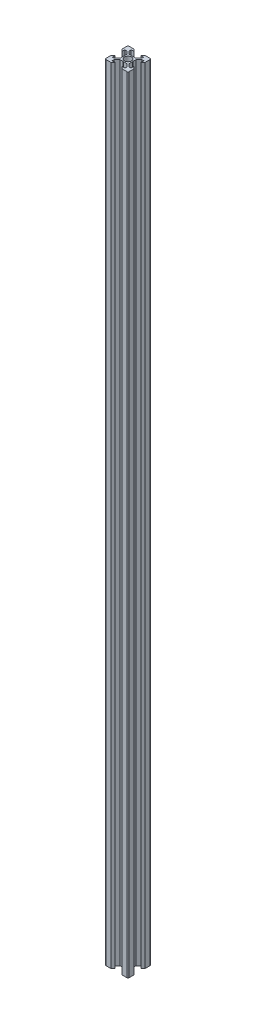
SolidWorks part; units mm, degrees
ref_plane "Front Plane" through (0, 0, 0) normal (0, 0, 1) x (1, 0, 0)
ref_plane "Top Plane" through (0, 0, 0) normal (0, 1, 0) x (1, 0, 0)
ref_plane "Right Plane" through (0, 0, 0) normal (1, 0, 0) x (0, 0, -1)
sketch "Sketch1" plane through (0, 0, 0) normal (0, 1, 0) x (1, 0, 0)
  line L0 (9.9996, -8.9996) -> (9.9996, -4.7998)
  line L1 (9.9996, -4.7998) -> (8.1997, -2.9999)
  line L2 (8.1997, -2.9999) -> (8.1997, -5.4998)
  line L3 (8.1997, -5.4998) -> (6.5604, -5.4998)
  line L4 (6.5604, -5.4998) -> (3.9998, -2.9392)
  line L5 (3.9998, -2.9392) -> (3.9998, -0.3)
  line L6 (3.9998, -0.3) -> (3.6999, 0)
  line L7 (3.6999, 0) -> (3.9998, 0.3)
  line L8 (3.9998, 0.3) -> (3.9998, 2.9392)
  line L9 (3.9998, 2.9392) -> (6.5604, 5.4998)
  line L10 (6.5604, 5.4998) -> (8.1997, 5.4998)
  line L11 (8.1997, 5.4998) -> (8.1997, 2.9999)
  line L12 (8.1997, 2.9999) -> (9.9996, 4.7998)
  line L13 (9.9996, 4.7998) -> (9.9996, 8.9996)
  line L14 (8.9996, 9.9996) -> (4.7998, 9.9996)
  line L15 (4.7998, 9.9996) -> (2.9999, 8.1997)
  line L16 (2.9999, 8.1997) -> (5.4998, 8.1997)
  line L17 (5.4998, 8.1997) -> (5.4998, 6.5604)
  line L18 (5.4998, 6.5604) -> (2.9392, 3.9998)
  line L19 (2.9392, 3.9998) -> (0.3, 3.9998)
  line L20 (0.3, 3.9998) -> (0, 3.6999)
  line L21 (0, 3.6999) -> (-0.3, 3.9998)
  line L22 (-0.3, 3.9998) -> (-2.9392, 3.9998)
  line L23 (-2.9392, 3.9998) -> (-5.4998, 6.5604)
  line L24 (-5.4998, 6.5604) -> (-5.4998, 8.1997)
  line L25 (-5.4998, 8.1997) -> (-2.9999, 8.1997)
  line L26 (-2.9999, 8.1997) -> (-4.7998, 9.9996)
  line L27 (-4.7998, 9.9996) -> (-8.9996, 9.9996)
  line L28 (-9.9996, 8.9996) -> (-9.9996, 4.7998)
  line L29 (-9.9996, 4.7998) -> (-8.1997, 2.9999)
  line L30 (-8.1997, 2.9999) -> (-8.1997, 5.4998)
  line L31 (-8.1997, 5.4998) -> (-6.5604, 5.4998)
  line L32 (-6.5604, 5.4998) -> (-3.9998, 2.9392)
  line L33 (-3.9998, 2.9392) -> (-3.9998, 0.3)
  line L34 (-3.9998, 0.3) -> (-3.6999, 0)
  line L35 (-3.6999, 0) -> (-3.9998, -0.3)
  line L36 (-3.9998, -0.3) -> (-3.9998, -2.9392)
  line L37 (-3.9998, -2.9392) -> (-6.5604, -5.4998)
  line L38 (-6.5604, -5.4998) -> (-8.1997, -5.4998)
  line L39 (-8.1997, -5.4998) -> (-8.1997, -2.9999)
  line L40 (-8.1997, -2.9999) -> (-9.9996, -4.7998)
  line L41 (-9.9996, -4.7998) -> (-9.9996, -8.9996)
  line L42 (-8.9996, -9.9996) -> (-4.7998, -9.9996)
  line L43 (-4.7998, -9.9996) -> (-2.9999, -8.1997)
  line L44 (-2.9999, -8.1997) -> (-5.4998, -8.1997)
  line L45 (-5.4998, -8.1997) -> (-5.4998, -6.5604)
  line L46 (-5.4998, -6.5604) -> (-2.9392, -3.9998)
  line L47 (-2.9392, -3.9998) -> (-0.3, -3.9998)
  line L48 (-0.3, -3.9998) -> (0, -3.6999)
  line L49 (0, -3.6999) -> (0.3, -3.9998)
  line L50 (0.3, -3.9998) -> (2.9392, -3.9998)
  line L51 (2.9392, -3.9998) -> (5.4998, -6.5604)
  line L52 (5.4998, -6.5604) -> (5.4998, -8.1997)
  line L53 (5.4998, -8.1997) -> (2.9999, -8.1997)
  line L54 (2.9999, -8.1997) -> (4.7998, -9.9996)
  line L55 (4.7998, -9.9996) -> (8.9996, -9.9996)
  arc A2 (8.9996, -9.9996) -> (9.9996, -8.9996) centre (8.9996, -8.9996) ccw
  arc A3 (9.9996, 8.9996) -> (8.9996, 9.9996) centre (8.9996, 8.9996) ccw
  arc A4 (-8.9996, 9.9996) -> (-9.9996, 8.9996) centre (-8.9996, 8.9996) ccw
  arc A5 (-9.9996, -8.9996) -> (-8.9996, -9.9996) centre (-8.9996, -8.9996) ccw
  circle A6 centre (0, 0) radius 3
  dimension "D1" = 6
extrude "Boss-Extrude1" add sketch "Sketch1" along normal blind 680
